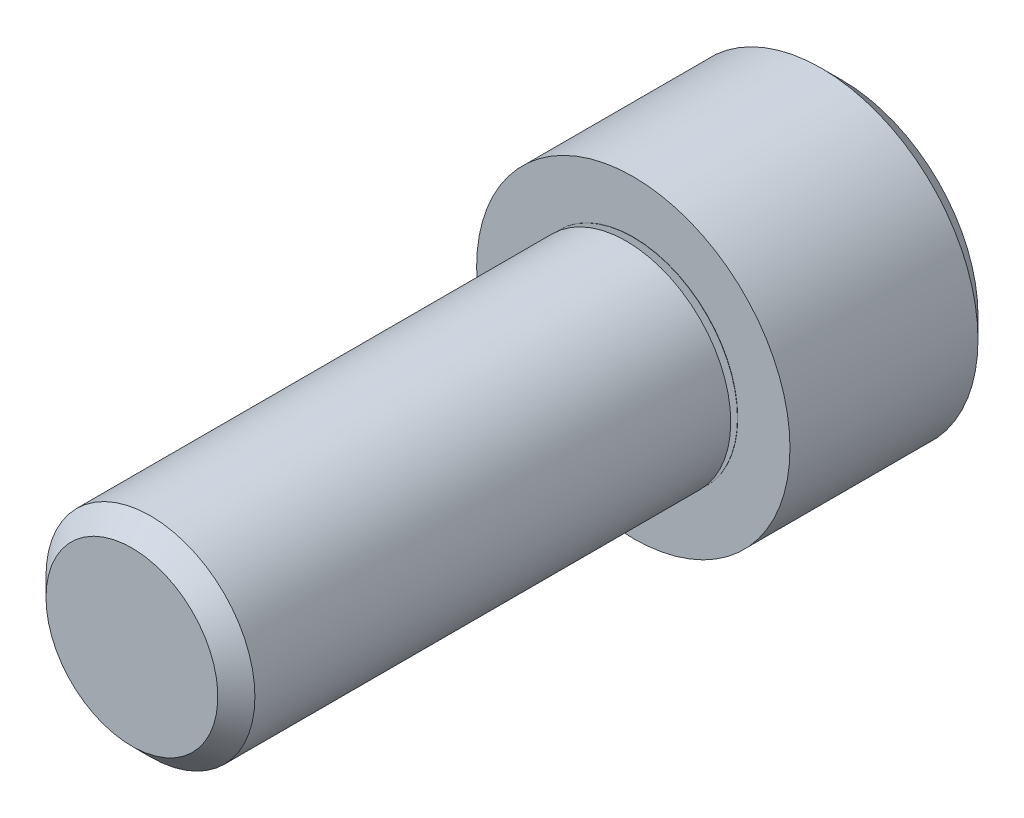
SolidWorks part; units mm, degrees
ref_plane "Front" through (0, 0, 0) normal (0, 0, 1) x (1, 0, 0)
ref_plane "Top" through (0, 0, 0) normal (0, 1, 0) x (1, 0, 0)
ref_plane "Right" through (0, 0, 0) normal (1, 0, 0) x (0, 0, -1)
sketch "Logo3_Revol_Axis" plane through (0, 0, 0) normal (0, 1, 0) x (1, 0, 0)
  line L0 (0, -43.5172) -> (0, 43.5172) construction
sketch "Logo3_bib1" plane through (0, 0, 0) normal (0, -1, 0) x (-1, 0, 0)
  line L0 (0, -19.05) -> (0, 7.9375)
  line L1 (0, 7.9375) -> (5.1594, 7.9375)
  line L2 (5.9531, 7.1437) -> (5.9531, 0)
  line L3 (5.9531, 0) -> (3.9688, 0)
  line L4 (3.9688, 0) -> (3.9688, -0.01)
  line L5 (3.9688, -18.3451) -> (3.2639, -19.05)
  line L6 (3.2639, -19.05) -> (0, -19.05)
  line L7 (3.9688, -0.01) -> (3.3773, -0.01)
  line L8 (3.3705, -0.0488) -> (3.9688, -0.2665)
  line L9 (3.9688, -0.2665) -> (3.9688, -18.3451)
  line L10 (0, 10.5852) -> (0, -63.2873) construction
  line L11 (5.1594, 7.9375) -> (5.9531, 7.1437)
  arc A1 (3.3773, -0.01) -> (3.3705, -0.0488) centre (3.3773, -0.03) ccw
  point P17 (3.2639, -0.01)
  point P19 (5.9531, 7.9375)
revolve "Revolve1" add sketch "Logo3_bib1" angle 360 about L10
sketch "Logo3_bib2" plane through (0, 0, -7.9375) normal (0, 0, -1) x (1, 0, 0)
  line L1 (3.6662, 0) -> (1.8331, 3.175)
  line L2 (1.8331, 3.175) -> (-1.8331, 3.175)
  line L3 (-1.8331, 3.175) -> (-3.6662, 0)
  line L4 (-3.6662, 0) -> (-1.8331, -3.175)
  line L5 (-1.8331, -3.175) -> (1.8331, -3.175)
  line L6 (1.8331, -3.175) -> (3.6662, 0)
  circle A0 centre (0, 0) radius 3.175 construction
  dimension "Logo3_c1" = 6.35
extrude "Cut-Extrude1" cut sketch "Logo3_bib2" against normal blind 3.9688
equation "\"DIA2@Logo3_bib1\" = \"Logo3_d1-pas@Logo3_bib1\""
equation "\"LGT1@Logo3_bib1\" = \"Logo3_d1@Logo3_bib1\""
equation "\"D1@Cut-Extrude1\" = \"Logo3_d1@Logo3_bib1\"/2."
equation "\"D2@Cosmetic Thread1\" = \"Logo3_d1-pas@Logo3_bib1\""
equation "\"D5@Logo3_bib1\"=\"Logo3_d1@Logo3_bib1\"*.1"
